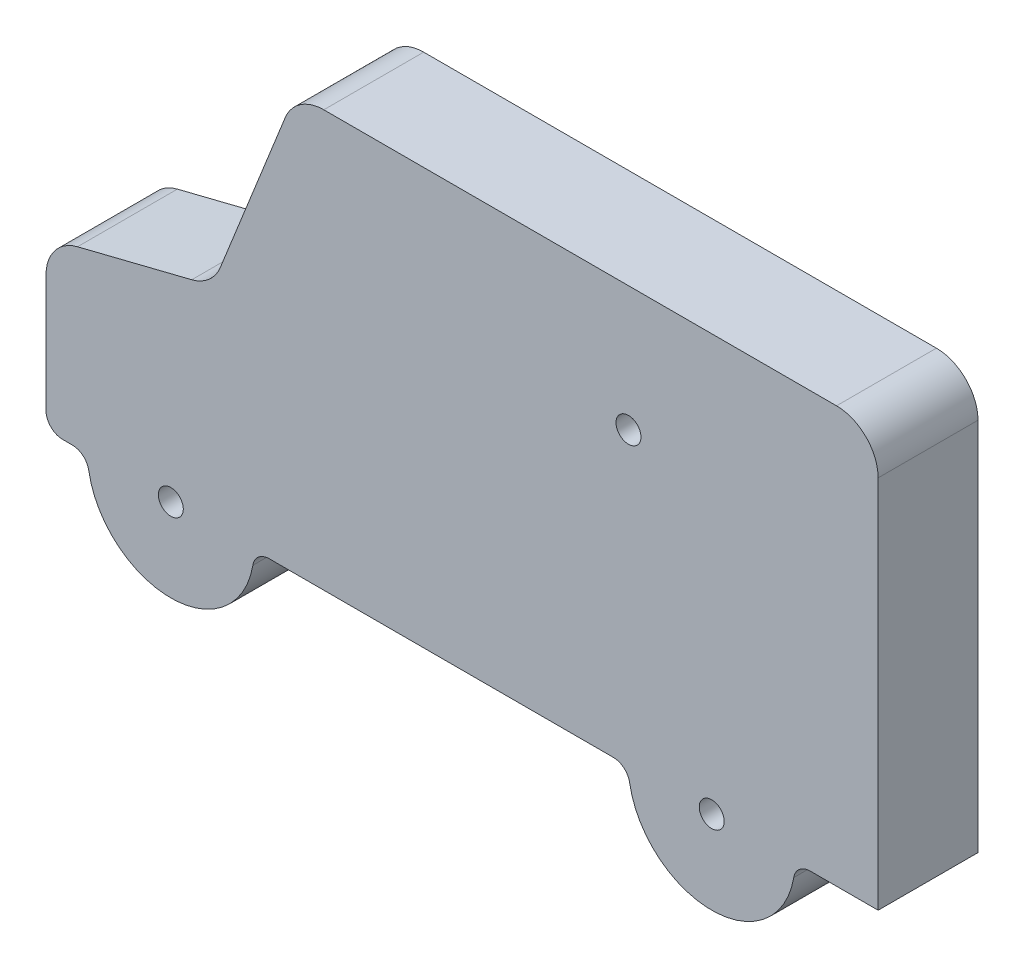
SolidWorks part; units mm, degrees
ref_plane "Plan de face" through (0, 0, 0) normal (0, 0, 1) x (1, 0, 0)
ref_plane "Plan de dessus" through (0, 0, 0) normal (0, 1, 0) x (1, 0, 0)
ref_plane "Plan de droite" through (0, 0, 0) normal (1, 0, 0) x (0, 0, -1)
sketch "Esquisse1" plane through (0, 0, 0) normal (0, 0, 1) x (1, 0, 0)
  line L0 (3.7873, 20.9468) -> (17.5198, 24.3799)
  line L1 (2, 0) -> (3.1678, 0)
  line L2 (0, 2) -> (0, 16.0961)
  line L3 (33.3852, 50) -> (95, 50)
  line L4 (100, 0) -> (100, 45)
  line L5 (20.9495, 27.3737) -> (28.7428, 46.857)
  line L6 (91.8322, 0) -> (100, 0)
  line L7 (26.8322, 0) -> (68.1678, 0)
  circle A0 centre (15, 0) radius 1.5
  circle A1 centre (80, 0) radius 1.5
  arc A2 (5.1399, -1.6667) -> (24.8601, -1.6667) centre (15, 0) ccw
  arc A3 (70.1399, -1.6667) -> (89.8601, -1.6667) centre (80, 0) ccw
  arc A4 (95, 50) -> (100, 45) centre (95, 45) cw
  arc A5 (28.7428, 46.857) -> (33.3852, 50) centre (33.3852, 45) cw
  arc A6 (3.7873, 20.9468) -> (0, 16.0961) centre (5, 16.0961) ccw
  arc A7 (17.5198, 24.3799) -> (20.9495, 27.3737) centre (16.3071, 29.2307) ccw
  arc A8 (2, 0) -> (0, 2) centre (2, 2) cw
  arc A9 (5.1399, -1.6667) -> (3.1678, 0) centre (3.1678, -2) ccw
  arc A10 (26.8322, 0) -> (24.8601, -1.6667) centre (26.8322, -2) ccw
  arc A11 (68.1678, 0) -> (70.1399, -1.6667) centre (68.1678, -2) cw
  arc A12 (91.8322, 0) -> (89.8601, -1.6667) centre (91.8322, -2) ccw
  point P16 (100, 50)
  point P20 (0, 20)
  point P23 (20, 25)
  point P25 (0, 0)
  dimension "D1" = 5
  dimension "D2" = 2
  dimension "D8" = 15
  dimension "D9" = 5
  dimension "D7" = 20
  dimension "D5" = 2
  dimension "D3" = 20
  dimension "D4" = 25
  dimension "D6" = 20
extrude "Extrusion1" add sketch "Esquisse1" along normal blind 12
sketch "Esquisse2" plane through (0, 0, 12) normal (0, 0, 1) x (1, 0, 0)
  line L0 (95, 50) -> (33.3852, 50) construction
  line L1 (100, 0) -> (100, 45) construction
  circle A0 centre (70, 35) radius 1.5
  dimension "D1" = 15
  dimension "D2" = 30
extrude "Enlèv. mat.-Extru.1" cut sketch "Esquisse2" against normal blind 11
